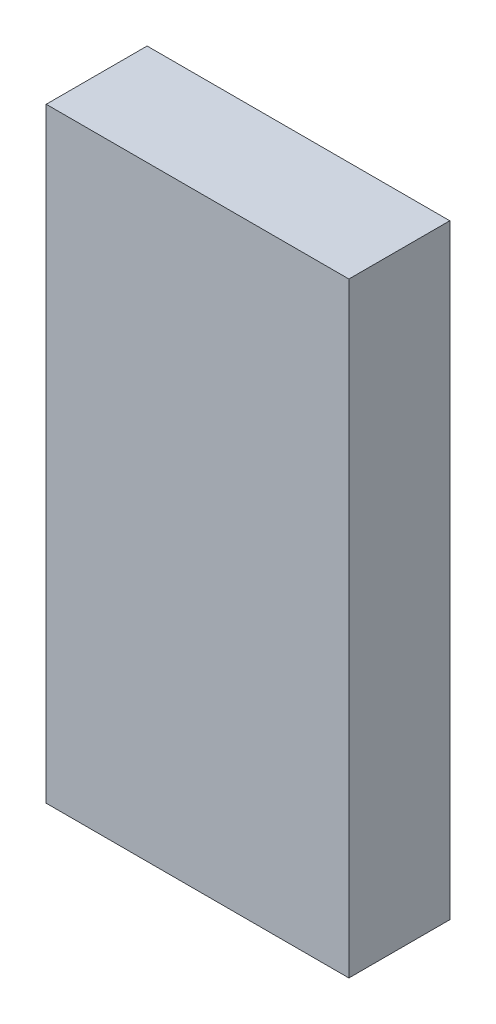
SolidWorks part; units mm, degrees
ref_plane "Plan de face" through (0, 0, 0) normal (0, 0, 1) x (1, 0, 0)
ref_plane "Plan de dessus" through (0, 0, 0) normal (0, 1, 0) x (1, 0, 0)
ref_plane "Plan de droite" through (0, 0, 0) normal (1, 0, 0) x (0, 0, -1)
sketch "Esquisse1" plane through (0, 0, 0) normal (0, 0, 1) x (1, 0, 0)
  line L1 (0, 0) -> (30, 0)
  line L2 (0, 0) -> (0, -60)
  line L3 (0, -60) -> (30, -60)
  line L4 (30, 0) -> (30, -60)
  dimension "D1" = 30
  dimension "D2" = 60
extrude "Extrusion1" add sketch "Esquisse1" along normal blind 10
